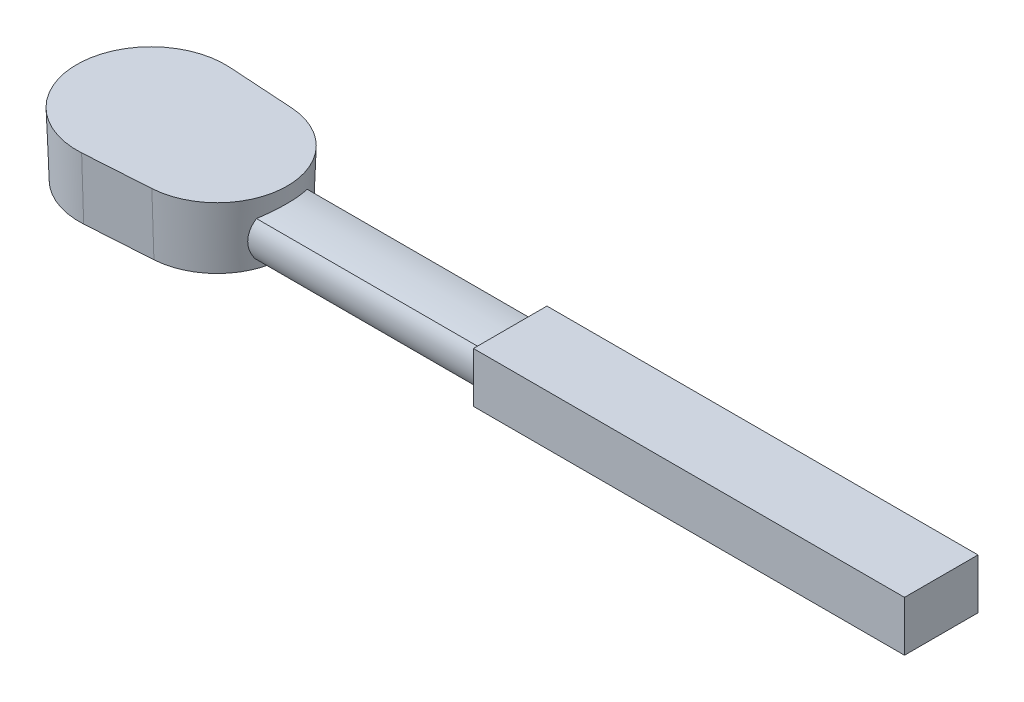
SolidWorks part; units mm, degrees
ref_plane "Front Plane" through (0, 0, 0) normal (0, 0, 1) x (1, 0, 0)
ref_plane "Top Plane" through (0, 0, 0) normal (0, 1, 0) x (1, 0, 0)
ref_plane "Right Plane" through (0, 0, 0) normal (1, 0, 0) x (0, 0, -1)
sketch "Sketch1" plane through (0, 0, 0) normal (0, 1, 0) x (1, 0, 0)
  line L0 (3.2486, 50.834) -> (49.923, 47.8512)
  line L1 (0, 0) -> (46.865, 0) construction
  line L2 (3.2486, -50.834) -> (49.923, -47.8512)
  arc A0 (3.2486, 50.834) -> (3.2486, -50.834) centre (0, 0) ccw
  arc A1 (49.923, -47.8512) -> (49.923, 47.8512) centre (46.865, 0) ccw
extrude "Extrude1" add sketch "Sketch1" along normal blind 44.45 draft 2
sketch "Sketch2" plane through (0, 0, 0) normal (1, 0, 0) x (0, 0, -1)
  line L0 (0, 19.05) -> (41.5371, 19.05) construction
  line L1 (0, 19.05) -> (0, 45.4101) construction
  arc A0 (-17.9305, 31.5804) -> (-17.9305, 6.5196) centre (0, 19.05) ccw
  arc A1 (-17.9305, 31.5804) -> (17.9305, 31.5804) centre (0, -55.5675) cw
  arc A2 (-17.9305, 6.5196) -> (17.9305, 6.5196) centre (0, 93.6675) ccw
  arc A3 (17.9305, 6.5196) -> (17.9305, 31.5804) centre (0, 19.05) ccw
extrude "Extrude2" add sketch "Sketch2" along normal blind 254
sketch "Sketch3" plane through (254, 0, 0) normal (1, 0, 0) x (0, 0, -1)
  line L0 (17.9305, 31.5804) -> (-17.9305, 6.5196) construction
  line L1 (-25.9873, 36.7831) -> (25.9873, 36.7831)
  line L2 (-25.9873, 36.7831) -> (-25.9873, 1.3169)
  line L3 (-25.9873, 1.3169) -> (25.9873, 1.3169)
  line L4 (25.9873, 36.7831) -> (25.9873, 1.3169)
  line L5 (0, 19.05) -> (0, 36.7831) construction
  line L6 (0, 19.05) -> (25.9873, 19.05) construction
extrude "Extrude3" add sketch "Sketch3" along normal blind 304.8
